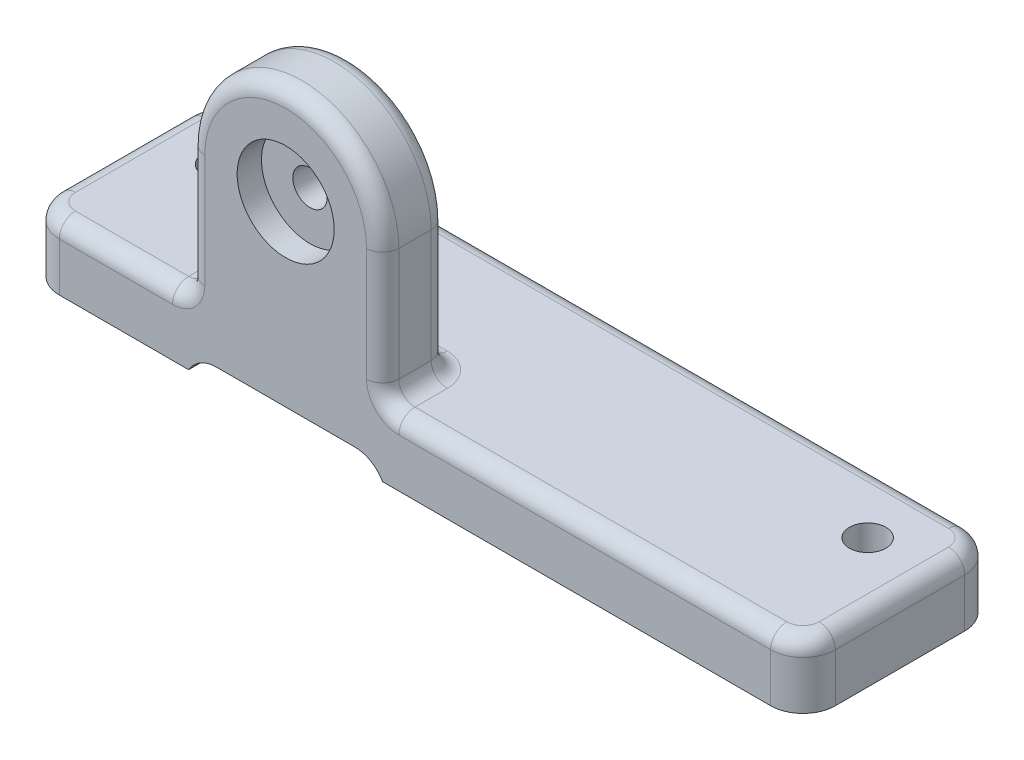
SolidWorks part; units mm, degrees
ref_plane "Front Plane" through (0, 0, 0) normal (0, 0, 1) x (1, 0, 0)
ref_plane "Top Plane" through (0, 0, 0) normal (0, 1, 0) x (1, 0, 0)
ref_plane "Right Plane" through (0, 0, 0) normal (1, 0, 0) x (0, 0, -1)
sketch "Sketch1" plane through (0, 0, 0) normal (0, 1, 0) x (1, 0, 0)
  line L1 (0, 0) -> (152.4, 0)
  line L2 (0, 0) -> (0, 38.1)
  line L3 (0, 38.1) -> (152.4, 38.1)
  line L4 (152.4, 0) -> (152.4, 38.1)
  dimension "D1" = 38.1
  dimension "D2" = 152.4
extrude "BasePlate" add sketch "Sketch1" along normal blind 12.7
sketch "Sketch2" plane through (0, 0, 0) normal (0, 0, 1) x (1, 0, 0)
  line L0 (31.75, 0) -> (31.75, 38.1)
  line L1 (0, 0) -> (152.4, 0) construction
  line L2 (69.85, 38.1) -> (69.85, 0)
  line L3 (69.85, 0) -> (31.75, 0)
  line L6 (0, 12.7) -> (0, 0) construction
  arc A0 (31.75, 38.1) -> (69.85, 38.1) centre (50.8, 38.1) cw
  dimension "D1" = 19.05
  dimension "D2" = 50.8
  dimension "D3" = 38.1
extrude "Extrude2" add sketch "Sketch2" against normal blind 12.7
hole_wizard "9/32 (0.28125) Diameter Hole3" positions "Sketch22" profile "Sketch23" hole size "9/32" standard "Ansi Inch"
sketch "Sketch22" plane through (0, 12.7, 0) normal (0, 1, 0) x (-1, 0, 0)
  line L0 (-152.4, 0) -> (-152.4, -38.1) construction
  line L1 (-152.4, -38.1) -> (0, -38.1) construction
  line L2 (0, -38.1) -> (0, 0) construction
  point P0 (-139.7, -25.4)
  point P5 (-12.7, -25.4)
  dimension "D1" = 12.7
  dimension "D2" = 12.7
  dimension "D3" = 12.7
sketch "Sketch23" plane through (139.7, 12.7, -25.4) normal (1, 0, 0) x (0, 0, 1)
  line L0 (0, 0) -> (0, 12.7)
  line L1 (0, 12.7) -> (3.5725, 12.7)
  line L2 (3.5725, 12.7) -> (3.5725, 0)
  line L5 (3.5725, 0) -> (0, 0)
  line L11 (0, -6.35) -> (0, 107.95) construction
  dimension "Thru Hole Dia." = 7.145
  dimension "Thru Hole Depth" = 12.7
hole_wizard "CBORE for 1/4 Hex Head Bolt1" positions "Sketch25" profile "Sketch26" counterbore size "1/4" standard "Ansi Inch"
sketch "Sketch25" plane through (0, 0, 0) normal (0, 0, 1) x (1, 0, 0)
  point P0 (50.8, 38.1)
sketch "Sketch26" plane through (50.8, 38.1, 0) normal (1, 0, 0) x (0, -1, 0)
  line L0 (0, 0) -> (0, 38.1)
  line L1 (0, 38.1) -> (3.3782, 38.1)
  line L3 (3.3782, 38.1) -> (3.3782, 4.7752)
  line L4 (3.3782, 4.7752) -> (9.525, 4.7752)
  line L5 (9.525, 4.7752) -> (9.525, 0)
  line L7 (9.525, 0) -> (0, 0)
  line L11 (0, -6.35) -> (0, 107.95) construction
  dimension "Thru Hole Dia." = 6.7564
  dimension "Thru Hole Depth" = 38.1
  dimension "C'Bore Dia." = 19.05
  dimension "C'Bore Depth" = 4.7752
sketch "Sketch27" plane through (0, 0, 0) normal (0, 0, 1) x (1, 0, 0)
  line L0 (0, 0) -> (152.4, 0) construction
  line L1 (31.75, 0) -> (69.85, 0)
  line L2 (31.75, 0) -> (31.75, 3.175)
  line L3 (31.75, 3.175) -> (69.85, 3.175)
  line L4 (69.85, 0) -> (69.85, 3.175)
  line L5 (69.85, 12.7) -> (69.85, 38.1) construction
  line L6 (31.75, 38.1) -> (31.75, 12.7) construction
  dimension "D1" = 3.175
extrude "Cut-Extrude1" cut sketch "Sketch27" against normal through all
fillet "Fillet1" radius 6.35 6 edges at (31.75, 3.175, -19.05) (69.85, 3.175, -19.05) (152.4, 6.35, -38.1) (152.4, 6.35, 0) (0, 6.35, -38.1) (0, 6.35, 0)
fillet "Fillet2" radius 3.175 18 edges at (1.8599, 12.7, -36.2401) (0, 12.7, -19.05) (76.2, 12.7, -38.1) (1.8599, 12.7, -1.8599) (150.5401, 12.7, -36.2401) (19.05, 12.7, 0) (152.4, 12.7, -19.05) (31.75, 12.7, -6.35) (150.5401, 12.7, -1.8599) (50.8, 12.7, -12.7) (107.95, 12.7, 0) (69.85, 25.4, -12.7) (31.75, 25.4, -12.7) (69.85, 25.4, 0) (31.75, 25.4, 0) (69.85, 12.7, -6.35) (50.8, 57.15, -12.7) (50.8, 57.15, 0)
